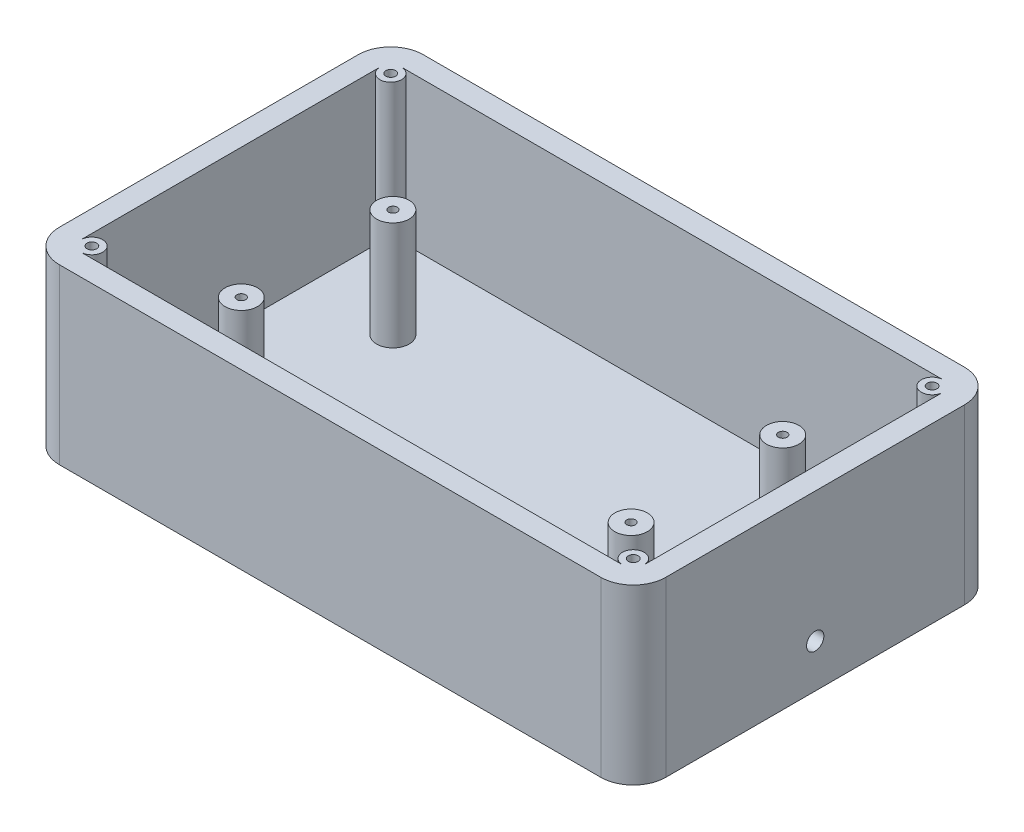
SolidWorks part; units mm, degrees
other "DetailItem1"
other "DetailItem2"
other "DetailItem3"
ref_plane "Front Plane" through (0, 0, 0) normal (0, 0, 1) x (1, 0, 0)
ref_plane "Top Plane" through (0, 0, 0) normal (0, 1, 0) x (1, 0, 0)
ref_plane "Right Plane" through (0, 0, 0) normal (1, 0, 0) x (0, 0, -1)
sketch "Sketch1" plane through (0, 0, 0) normal (0, 1, 0) x (1, 0, 0)
  line L1 (-88.9, -53.34) -> (88.9, -53.34)
  line L2 (-88.9, -53.34) -> (-88.9, 53.34)
  line L3 (-88.9, 53.34) -> (88.9, 53.34)
  line L4 (88.9, -53.34) -> (88.9, 53.34)
  line L5 (-88.9, -53.34) -> (88.9, 53.34) construction
  line L6 (-88.9, 53.34) -> (88.9, -53.34) construction
  point P0 (0, 0)
  dimension "D1" = 106.68
  dimension "D2" = 177.8
extrude "Boss-Extrude1" add sketch "Sketch1" against normal blind 50.8
fillet "Fillet1" radius 9.525 4 edges at (88.9, -25.4, 53.34) (88.9, -25.4, -53.34) (-88.9, -25.4, -53.34) (-88.9, -25.4, 53.34)
shell "Shell2" thickness 6.35
sketch "Sketch2" plane through (0, -44.45, 0) normal (0, 1, 0) x (1, 0, 0)
  circle A0 centre (-79.375, 43.815) radius 3.175
  arc A1 (-79.375, 46.99) -> (-82.55, 43.815) centre (-79.375, 43.815) ccw construction
extrude "Boss-Extrude2" add sketch "Sketch2" along normal up to surface (44.45 mm away)
mirror "Mirror1" about plane through (0, 0, 0) normal (1, 0, 0) of "Boss-Extrude2"
mirror "Mirror2" about plane through (0, 0, 0) normal (0, 0, 1) of "Mirror1", "Boss-Extrude2"
hole_wizard "#6-40 Tapped Hole1" positions "3DSketch1" profile "Sketch3" tap size "#6-40" standard "ANSI Inch"
sketch3d "3DSketch1"
  line L0 (-79.375, 0, -43.815) -> (-79.375, -44.45, -43.815) construction
  line L1 (-79.375, 0, 43.815) -> (-79.375, -44.45, 43.815) construction
  line L2 (79.375, 0, 43.815) -> (79.375, -44.45, 43.815) construction
  line L3 (79.375, 0, -43.815) -> (79.375, -44.45, -43.815) construction
  point P0 (-79.375, 0, -43.815)
  point P4 (-79.375, 0, 43.815)
  point P8 (79.375, 0, 43.815)
  point P12 (79.375, 0, -43.815)
sketch "Sketch3" plane through (-79.375, 0, -43.815) normal (1, 0, 0) x (0, 0, 1)
  line L0 (0, 0) -> (0, 13.5623)
  line L1 (0, 13.5623) -> (1.4351, 12.7)
  line L2 (1.4351, 12.7) -> (1.4351, 0)
  line L5 (1.4351, 0) -> (0, 0)
  line L10 (0, 13.5623) -> (-1.4351, 12.7) construction
  line L11 (0, -6.35) -> (0, 107.95) construction
  dimension "Tap Drill Dia." = 2.8702
  dimension "Tap Drill Depth" = 12.7
  dimension "Drill Angle" = 118
sketch "Sketch4" plane through (0, -44.45, 0) normal (0, 1, 0) x (1, 0, 0)
  line L0 (0, -55) -> (0, 55) construction
  line L5 (-57.15, 22.225) -> (57.15, -22.225) construction
  line L6 (-57.15, -22.225) -> (57.15, 22.225) construction
  line L7 (-55, 0) -> (55, 0) construction
  circle A0 centre (-57.15, 22.225) radius 4.7625
  circle A1 centre (57.15, 22.225) radius 4.7625
  circle A2 centre (-57.15, -22.225) radius 4.7625
  circle A3 centre (57.15, -22.225) radius 4.7625
  point P0 (0, 0)
  dimension "D3" = 9.525
  dimension "D1" = 114.3
  dimension "D2" = 44.45
extrude "Boss-Extrude3" add sketch "Sketch4" along normal offset from surface (31.75 mm away) 12.7
hole_wizard "#6-40 Tapped Hole2" positions "3DSketch2" profile "Sketch5" tap size "#6-40" standard "ANSI Inch"
sketch3d "3DSketch2"
  line L0 (-57.15, -12.7, -22.225) -> (-57.15, -44.45, -22.225) construction
  line L1 (57.15, -12.7, -22.225) -> (57.15, -44.45, -22.225) construction
  line L2 (-57.15, -12.7, 22.225) -> (-57.15, -44.45, 22.225) construction
  circle A0 centre (57.15, -12.7, 22.225) radius 4.7625 construction
  point P0 (-57.15, -12.7, -22.225)
  point P4 (57.15, -12.7, -22.225)
  point P8 (-57.15, -12.7, 22.225)
  point P12 (57.15, -12.7, 22.225)
  point P18 (57.15, -17.4625, 22.225)
sketch "Sketch5" plane through (-57.15, -12.7, -22.225) normal (1, 0, 0) x (0, 0, 1)
  line L0 (0, 0) -> (0, 9.6785)
  line L1 (0, 9.6785) -> (1.27, 8.9154)
  line L2 (1.27, 8.9154) -> (1.27, 0)
  line L5 (1.27, 0) -> (0, 0)
  line L10 (0, 9.6785) -> (-1.27, 8.9154) construction
  line L11 (0, -6.35) -> (0, 107.95) construction
  dimension "Tap Drill Dia." = 2.54
  dimension "Tap Drill Depth" = 8.9154
  dimension "Drill Angle" = 118
sketch "Sketch7" plane through (-88.9, 0, 0) normal (-1, 0, 0) x (0, 0, 1)
  line L0 (-43.815, -50.8) -> (43.815, -50.8) construction
  circle A0 centre (0, -38.1) radius 2.667
  dimension "D1" = 5.334
  dimension "D2" = 12.7
extrude "Cut-Extrude1" cut sketch "Sketch7" against normal blind 12.7
sketch "Sketch8" plane through (88.9, 0, 0) normal (1, 0, 0) x (0, 0, -1)
  line L2 (-43.815, -50.8) -> (43.815, -50.8) construction
  line L3 (0, 55) -> (0, -55) construction
  circle A0 centre (0, -38.1) radius 2.54
  dimension "D2" = 5.08
  dimension "D1" = 12.7
extrude "Cut-Extrude2" cut sketch "Sketch8" against normal blind 13.97
hole_wizard "#6-40 Tapped Hole3" positions "3DSketch3" profile "Sketch9" tap size "#6-40" standard "ANSI Inch"
sketch3d "3DSketch3"
  circle A0 centre (-57.15, -12.7, -22.225) radius 4.7625 construction
  circle A1 centre (-57.15, -12.7, 22.225) radius 4.7625 construction
  circle A2 centre (57.15, -12.7, 22.225) radius 4.7625 construction
  circle A3 centre (57.15, -12.7, -22.225) radius 4.7625 construction
  point P0 (-57.15, -50.8, -22.225)
  point P2 (-57.15, -50.8, 22.225)
  point P4 (57.15, -50.8, 22.225)
  point P6 (57.15, -50.8, -22.225)
  point P12 (-57.15, -17.4625, -22.225)
  point P16 (-57.15, -17.4625, 22.225)
  point P20 (57.15, -17.4625, 22.225)
  point P24 (57.15, -17.4625, -22.225)
sketch "Sketch9" plane through (-57.15, -50.8, -22.225) normal (1, 0, 0) x (0, 0, -1)
  line L0 (0, 0) -> (0, 9.6785)
  line L1 (0, 9.6785) -> (1.27, 8.9154)
  line L2 (1.27, 8.9154) -> (1.27, 0)
  line L5 (1.27, 0) -> (0, 0)
  line L10 (0, 9.6785) -> (-1.27, 8.9154) construction
  line L11 (0, -6.35) -> (0, 107.95) construction
  dimension "Tap Drill Dia." = 2.54
  dimension "Tap Drill Depth" = 8.9154
  dimension "Drill Angle" = 118
